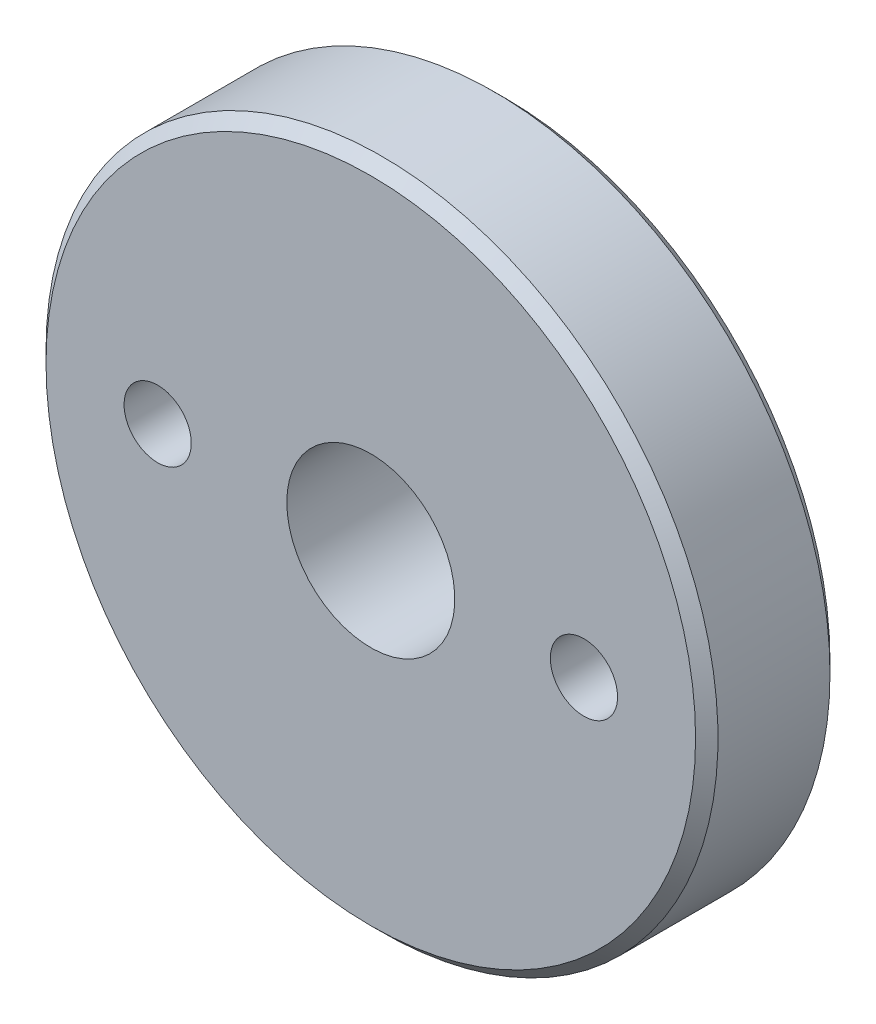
SolidWorks part; units mm, degrees
ref_plane "Face" through (0, 0, 0) normal (0, 0, 1) x (1, 0, 0)
ref_plane "Dessus" through (0, 0, 0) normal (0, 1, 0) x (1, 0, 0)
ref_plane "Droite" through (0, 0, 0) normal (1, 0, 0) x (0, 0, -1)
sketch "Esquisse1" plane through (0, 0, 0) normal (0, 0, 1) x (1, 0, 0)
  circle A0 centre (0, 0) radius 6
  circle A1 centre (0, 0) radius 1.5
  dimension "D1" = 12
  dimension "D2" = 3
extrude "Base-Extrusion" add sketch "Esquisse1" along normal up to surface (2.4 mm away)
hole_wizard "Dégagement pour M12" positions "Esquisse3D1" profile "Esquisse4" hole size "M1" standard "ISO"
sketch3d "Esquisse3D1"
  line L0 (0, 0, 0) -> (-7.2536, 0, 0) construction
  point P0 (-3.8061, 0.0578, 2.4)
  dimension "D1" = 4.5
sketch "Esquisse4" plane through (-3.8061, 0.0578, 2.4) normal (1, 0, 0) x (0, -1, 0)
  line L0 (0, 0) -> (0, 1.3605)
  line L1 (0, 1.3605) -> (0.6, 1)
  line L2 (0.6, 1) -> (0.6, 0)
  line L5 (0.6, 0) -> (0, 0)
  line L10 (0, 1.3605) -> (-0.6, 1) construction
  line L11 (0, -6.35) -> (0, 107.95) construction
  dimension "Diamètre du perçage" = 1.2
  dimension "Profondeur du perçage" = 1
  dimension "Angle de pointe" = 118
pattern_circular "Répétition circulaire1" count 2 every 180
chamfer "Chanfrein1" distance 0.2 angle 45
